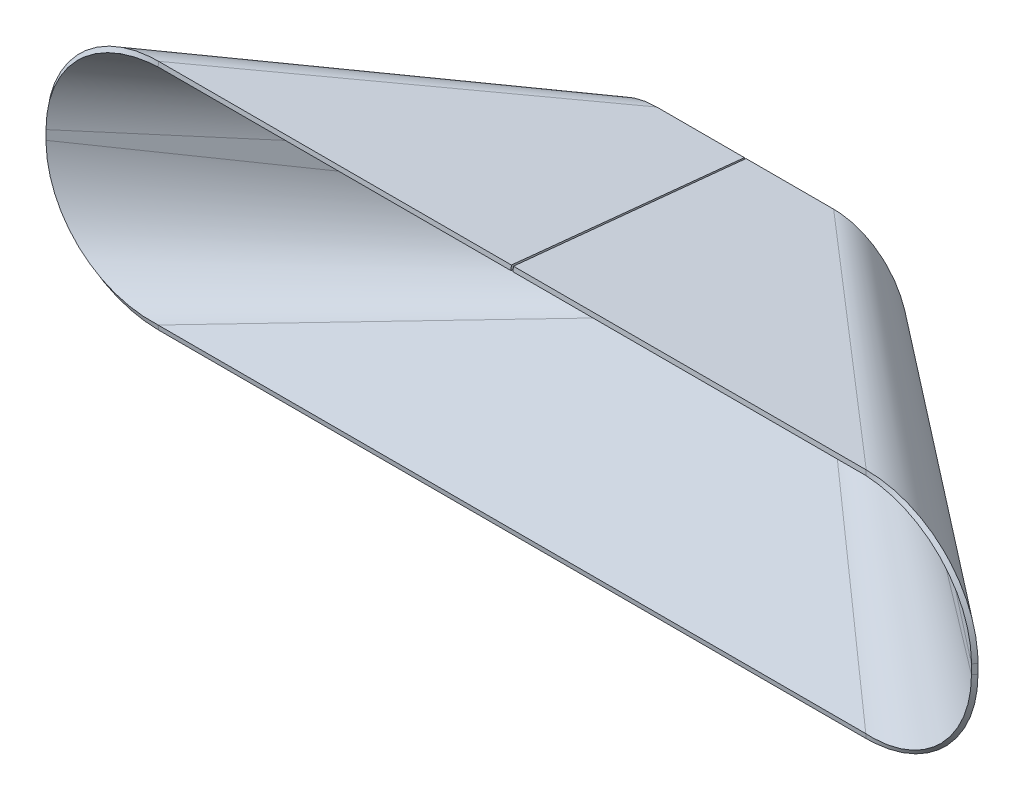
SolidWorks part; units mm, degrees
ref_plane "Ebene vorne" through (0, 0, 0) normal (0, 0, 1) x (1, 0, 0)
ref_plane "Ebene oben" through (0, 0, 0) normal (0, 1, 0) x (1, 0, 0)
ref_plane "Ebene rechts" through (0, 0, 0) normal (1, 0, 0) x (0, 0, -1)
sketch3d "3D-Skizze1"
  line L0 (-0.4363, 50, 125) -> (-47.5, 50, 125) construction
  line L1 (-87.5, -10, 125) -> (-87.5, 10, 125) construction
  line L3 (47.5, -50, 125) -> (-47.5, -50, 125) construction
  line L4 (87.5, -10, 125) -> (87.5, 10, 125) construction
  line L5 (47.5, 50, 125) -> (0.4363, 50, 125) construction
  line L6 (-0.4363, 50, 125) -> (-47.5, 50, 125)
  line L7 (-87.5, -10, 125) -> (-87.5, 10, 125)
  line L9 (47.5, -50, 125) -> (-47.5, -50, 125)
  line L10 (87.5, -10, 125) -> (87.5, 10, 125)
  line L11 (47.5, 50, 125) -> (0.4363, 50, 125)
  arc A0 (-47.5, 50, 125) -> (-87.5, 10, 125) centre (-47.5, 10, 125) ccw construction
  arc A1 (-47.5, -50, 125) -> (-87.5, -10, 125) centre (-47.5, -10, 125) ccw construction
  arc A2 (47.5, -50, 125) -> (87.5, -10, 125) centre (47.5, -10, 125) ccw construction
  arc A3 (87.5, 10, 125) -> (47.5, 50, 125) centre (47.5, 10, 125) ccw construction
  arc A4 (-47.5, 50, 125) -> (-87.5, 10, 125) centre (-47.5, 10, 125) ccw
  arc A5 (-47.5, -50, 125) -> (-87.5, -10, 125) centre (-47.5, -10, 125) ccw
  arc A6 (47.5, -50, 125) -> (87.5, -10, 125) centre (47.5, -10, 125) ccw
  arc A7 (87.5, 10, 125) -> (47.5, 50, 125) centre (47.5, 10, 125) ccw
  point P5 (-47.5, 10, 165)
  point P9 (-47.5, -10, 85)
  point P15 (47.5, -10, 165)
  point P17 (-47.5, 10, 165)
  point P19 (47.5, 10, 165)
  point P21 (-47.5, -10, 85)
  point P22 (47.5, -10, 165)
  point P23 (47.5, 10, 165)
sketch3d "3D-Skizze5"
  line L0 (190, 62.5, 250) -> (0.5454, 62.5, 250) construction
  line L1 (250, -2.5, 250) -> (250, 2.5, 250) construction
  line L2 (190, -62.5, 250) -> (-190, -62.5, 250) construction
  line L3 (-0.5454, 62.5, 250) -> (-190, 62.5, 250) construction
  line L4 (-250, -2.5, 250) -> (-250, 2.5, 250) construction
  line L5 (190, 62.5, 250) -> (0.5454, 62.5, 250)
  line L6 (250, -2.5, 250) -> (250, 2.5, 250)
  line L7 (190, -62.5, 250) -> (-190, -62.5, 250)
  line L8 (-0.5454, 62.5, 250) -> (-190, 62.5, 250)
  line L9 (-250, -2.5, 250) -> (-250, 2.5, 250)
  arc A0 (250, 2.5, 250) -> (190, 62.5, 250) centre (190, 2.5, 250) ccw construction
  arc A1 (190, -62.5, 250) -> (250, -2.5, 250) centre (190, -2.5, 250) ccw construction
  arc A2 (-190, 62.5, 250) -> (-250, 2.5, 250) centre (-190, 2.5, 250) ccw construction
  arc A3 (-190, -62.5, 250) -> (-250, -2.5, 250) centre (-190, -2.5, 250) ccw construction
  arc A4 (250, 2.5, 250) -> (190, 62.5, 250) centre (190, 2.5, 250) ccw
  arc A5 (190, -62.5, 250) -> (250, -2.5, 250) centre (190, -2.5, 250) ccw
  arc A6 (-190, 62.5, 250) -> (-250, 2.5, 250) centre (-190, 2.5, 250) ccw
  arc A7 (-190, -62.5, 250) -> (-250, -2.5, 250) centre (-190, -2.5, 250) ccw
  point P5 (190, 2.5, 310)
  point P9 (190, -2.5, 310)
  point P15 (-190, 2.5, 310)
  point P17 (190, 2.5, 310)
  point P18 (190, -2.5, 310)
  point P19 (-190, -2.5, 190)
  point P20 (-190, 2.5, 310)
  point P21 (-190, -2.5, 190)
sheet metal parameters "Blech1" thickness 2.5 parameters "D1"=0, "Dicke"=2.5
lofted bend "Ausgeformte Biegungen6" parameters "D1"=0, "D12"=2.5
other "Freiform-Biegung1" parameters "D1"=1000, "D4"=57.296, "D5"=1
other "Freiform-Biegung2" parameters "D1"=1000, "D4"=57.296, "D5"=2
other "Freiform-Biegung3" parameters "D1"=1000, "D4"=57.296, "D5"=3
other "Freiform-Biegung4" parameters "D1"=1000, "D4"=57.296, "D5"=4
flat pattern "Abwicklung1"
sketch "Biegung-Linien1" plane through (0, -37.1287, -3.7129) normal (0, 0.995, 0.0995) x (-1, 0, 0)
  line L0 (-116.7108, 89.7874) -> (-278.2977, 216.1883) construction
  line L1 (-121.1343, 27.9076) -> (-284.8495, 124.2655) construction
  line L2 (-47.5, 129.3548) -> (-190, 254.9783) construction
  line L3 (-104.9723, 105.9802) -> (-275.3631, 220.2365) construction
  line L4 (47.5, 129.3548) -> (190, 254.9783) construction
  line L5 (104.9723, 105.9803) -> (275.3631, 220.2365) construction
  line L6 (116.7108, 89.7874) -> (278.2977, 216.1883) construction
  line L7 (121.1343, 27.9076) -> (284.8495, 124.2655) construction
other "Abwickeln-<Freiform-Biegung1>1"
other "Abwickeln-<Freiform-Biegung2>1"
other "Abwickeln-<Freiform-Biegung3>1"
other "Abwickeln-<Freiform-Biegung4>1"
